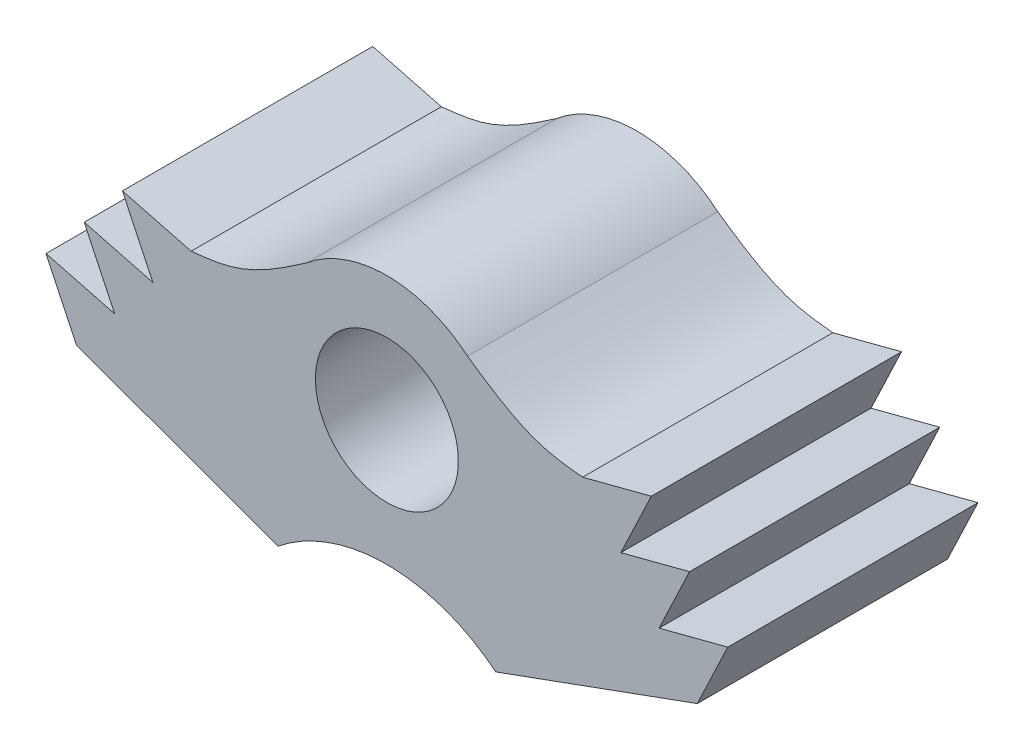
SolidWorks part; units mm, degrees
ref_plane "Face" through (0, 0, 0) normal (0, 0, 1) x (1, 0, 0)
ref_plane "Dessus" through (0, 0, 0) normal (0, 1, 0) x (1, 0, 0)
ref_plane "Droite" through (0, 0, 0) normal (1, 0, 0) x (0, 0, -1)
sketch "Esquisse1" plane through (0, 0, 0) normal (0, 0, 1) x (1, 0, 0)
  line L0 (0, 0) -> (0, 27.7888) construction
  line L1 (3.0463, 3.7563) -> (8.6844, 5.8085)
  line L2 (8.6844, 5.8085) -> (9.5365, 7.6021)
  line L3 (9.5365, 7.6021) -> (7.6147, 7.1019)
  line L4 (7.6147, 7.1019) -> (8.4668, 8.8955)
  line L5 (8.4668, 8.8955) -> (6.5451, 8.3953)
  line L6 (6.5451, 8.3953) -> (7.3971, 10.189)
  line L7 (7.3971, 10.189) -> (5.4754, 9.6887)
  line L8 (-7.3971, 10.189) -> (-5.4754, 9.6887)
  line L9 (-6.5451, 8.3953) -> (-7.3971, 10.189)
  line L10 (-8.4668, 8.8955) -> (-6.5451, 8.3953)
  line L11 (-7.6147, 7.1019) -> (-8.4668, 8.8955)
  line L12 (-9.5365, 7.6021) -> (-7.6147, 7.1019)
  line L13 (-8.6844, 5.8085) -> (-9.5365, 7.6021)
  line L14 (-3.0463, 3.7563) -> (-8.6844, 5.8085)
  arc A0 (3.0463, 3.7563) -> (-3.0463, 3.7563) centre (0, 0) ccw
  circle A1 centre (0, 8.3363) radius 2
  arc A2 (2.2559, 11.0123) -> (-2.2559, 11.0123) centre (0, 8.3363) ccw
  point P9 (0, 11.8363)
  point P10 (0, 4.8363)
  point P11 (3.0463, 3.7563)
  point P19 (4.4486, 9.8482)
  point P21 (0, 0)
  point P23 (-4.4486, 9.8482)
  dimension "D1" = 4
  dimension "D2" = 7
  dimension "D3" = 50
  dimension "D5" = 7
  dimension "D4" = 70
  dimension "D6" = 6
  dimension "D7" = 50
  dimension "D8" = 50
  dimension "D9" = 50
  dimension "D10" = 50
extrude "Base-Extrusion" add sketch "Esquisse1" along normal blind 7
